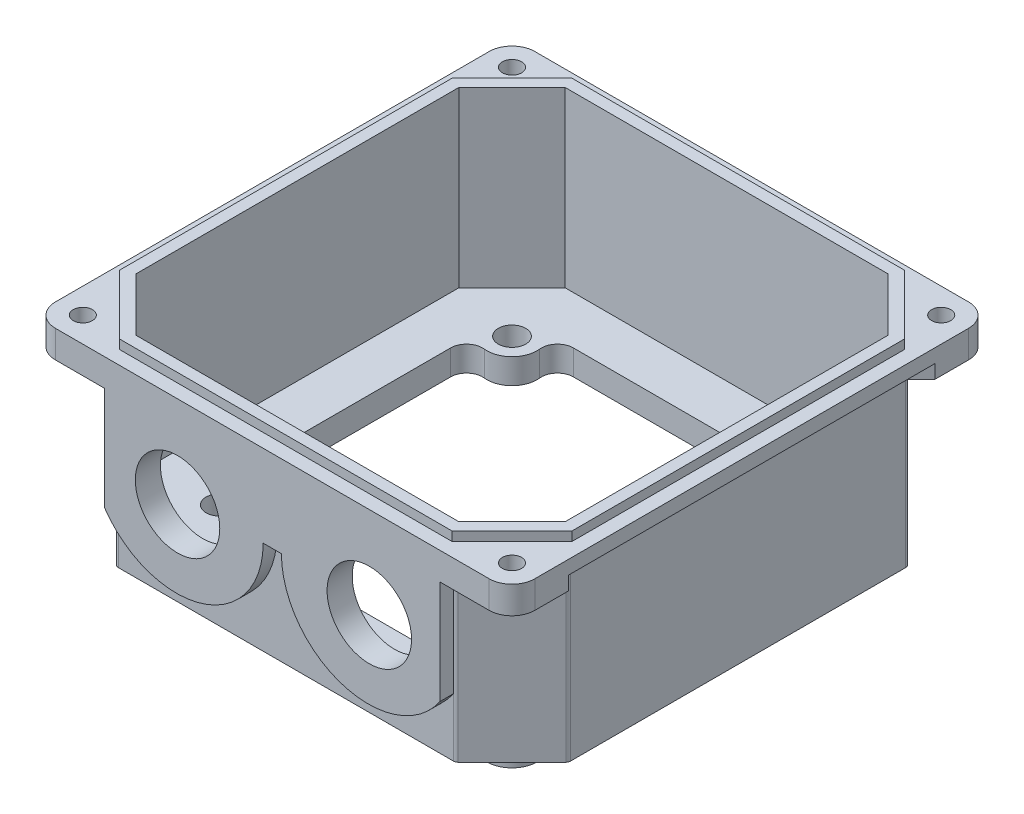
SolidWorks part; units mm, degrees
ref_plane "前视基准面" through (0, 0, 0) normal (0, 0, 1) x (1, 0, 0)
ref_plane "上视基准面" through (0, 0, 0) normal (0, 1, 0) x (1, 0, 0)
ref_plane "右视基准面" through (0, 0, 0) normal (1, 0, 0) x (0, 0, -1)
sketch "草图1" plane through (0, 0, 0) normal (0, 1, 0) x (1, 0, 0)
  line L1 (-52.5, -52.5) -> (52.5, -52.5)
  line L2 (-52.5, -52.5) -> (-52.5, 52.5)
  line L3 (-52.5, 52.5) -> (52.5, 52.5)
  line L4 (52.5, -52.5) -> (52.5, 52.5)
  line L5 (-52.5, -52.5) -> (52.5, 52.5) construction
  line L6 (-52.5, 52.5) -> (52.5, -52.5) construction
  point P0 (0, 0)
extrude "凸台-拉伸1" add sketch "草图1" along normal blind 38.5
sketch "草图2" plane through (0, 0, 0) normal (0, -1, 0) x (-1, 0, 0)
  line L1 (36, 41.5) -> (-36, 41.5)
  line L2 (41.5, 36) -> (41.5, -36)
  line L3 (36, -41.5) -> (-36, -41.5)
  line L4 (-41.5, 36) -> (-41.5, -36)
  line L5 (41.5, 41.5) -> (-41.5, -41.5) construction
  line L6 (41.5, -41.5) -> (-41.5, 41.5) construction
  line L7 (38.5, 44) -> (-38.5, 44)
  line L8 (44, 38.5) -> (44, -38.5)
  line L9 (38.5, -44) -> (-38.5, -44)
  line L10 (-44, 38.5) -> (-44, -38.5)
  line L11 (44, 44) -> (-44, -44) construction
  line L12 (44, -44) -> (-44, 44) construction
  arc A0 (38.5, 44) -> (44, 38.5) centre (38.5, 38.5) cw
  arc A1 (36, 41.5) -> (41.5, 36) centre (36, 36) cw
  arc A2 (-38.5, 44) -> (-44, 38.5) centre (-38.5, 38.5) ccw
  arc A3 (-36, 41.5) -> (-41.5, 36) centre (-36, 36) ccw
  arc A4 (-36, -41.5) -> (-41.5, -36) centre (-36, -36) cw
  arc A5 (-38.5, -44) -> (-44, -38.5) centre (-38.5, -38.5) cw
  arc A6 (41.5, -36) -> (36, -41.5) centre (36, -36) cw
  arc A7 (44, -38.5) -> (38.5, -44) centre (38.5, -38.5) cw
  point P0 (0, 0)
  point P5 (0, 0)
  dimension "D1" = 5.5
extrude "凸台-拉伸2" add sketch "草图2" along normal blind 2
sketch "草图3" plane through (0, 0, 0) normal (0, -1, 0) x (-1, 0, 0)
  line L2 (36.5, 23.0557) -> (36.5, -23.0557)
  line L5 (-36.5, 23.0557) -> (-36.5, -23.0557)
  line L6 (23.0557, 36.5) -> (-23.0557, 36.5)
  line L7 (23.0557, -36.5) -> (-23.0557, -36.5)
  line L8 (34.1213, -34.1213) -> (-34.1213, 34.1213) construction
  line L9 (34.1213, 34.1213) -> (-34.1213, -34.1213) construction
  circle A0 centre (-32, -32) radius 3
  arc A1 (-26.5341, -32.6111) -> (-32.6111, -26.5341) centre (-32, -32) ccw
  arc A2 (-32.6111, 26.5341) -> (-26.5341, 32.6111) centre (-32, 32) ccw
  circle A3 centre (-32, 32) radius 3
  arc A4 (26.5341, 32.6111) -> (32.6111, 26.5341) centre (32, 32) ccw
  circle A5 centre (32, 32) radius 3
  circle A7 centre (32, -32) radius 3
  arc A8 (32.6111, -26.5341) -> (26.5341, -32.6111) centre (32, -32) ccw
  arc A9 (35.1623, -36.5) -> (35.8891, -35.8891) centre (32, -32) ccw
  arc A10 (-23.0557, -36.5) -> (-26.5341, -32.6111) centre (-23.0557, -33) cw
  arc A11 (-32.6111, -26.5341) -> (-36.5, -23.0557) centre (-33, -23.0557) cw
  arc A12 (-32.6111, 26.5341) -> (-36.5, 23.0557) centre (-33, 23.0557) ccw
  arc A13 (-23.0557, 36.5) -> (-26.5341, 32.6111) centre (-23.0557, 33) ccw
  arc A14 (26.5341, 32.6111) -> (23.0557, 36.5) centre (23.0557, 33) ccw
  arc A15 (36.5, 23.0557) -> (32.6111, 26.5341) centre (33, 23.0557) ccw
  arc A16 (36.5, -23.0557) -> (32.6111, -26.5341) centre (33, -23.0557) cw
  arc A17 (26.5341, -32.6111) -> (23.0557, -36.5) centre (23.0557, -33) cw
  point P0 (0, 0)
  point P23 (0, 0)
  dimension "D1" = 4
  dimension "D2" = 3.5
extrude "切除-拉伸1" cut sketch "草图3" against normal through all
sketch "草图4" plane through (0, 38.5, 0) normal (0, 1, 0) x (1, 0, 0)
  line L0 (52.5, 52.5) -> (52.5, 34.1206)
  line L1 (34.1206, 52.5) -> (52.5, 34.1206)
  line L2 (52.5, -52.5) -> (52.5, 52.5) construction
  line L3 (52.5, 52.5) -> (34.1206, 52.5)
  line L4 (52.5, -52.5) -> (34.1206, -52.5)
  line L5 (52.5, -34.1206) -> (34.1206, -52.5)
  line L6 (52.5, -52.5) -> (52.5, -34.1206)
  line L7 (-52.5, -52.5) -> (-52.5, -34.1206)
  line L8 (-34.1206, -52.5) -> (-52.5, -34.1206)
  line L9 (-52.5, -52.5) -> (-34.1206, -52.5)
  line L10 (-52.5, 52.5) -> (-34.1206, 52.5)
  line L11 (-52.5, 34.1206) -> (-34.1206, 52.5)
  line L12 (-52.5, 52.5) -> (-52.5, 34.1206)
  point P18 (0, 0)
  dimension "D1" = 4
extrude "切除-拉伸2" cut sketch "草图4" against normal through all
sketch "草图5" plane through (0, 38.5, 0) normal (0, 1, 0) x (1, 0, 0)
  line L1 (52.5, -52.5) -> (-52.5, -52.5)
  line L2 (52.5, -52.5) -> (52.5, 52.5)
  line L3 (52.5, 52.5) -> (-52.5, 52.5)
  line L4 (-52.5, -52.5) -> (-52.5, 52.5)
  line L5 (52.5, -52.5) -> (-52.5, 52.5) construction
  line L6 (52.5, 52.5) -> (-52.5, -52.5) construction
  point P0 (0, 0)
extrude "凸台-拉伸3" add sketch "草图5" along normal blind 3
sketch "草图6" plane through (0, 0, 0) normal (0, -1, 0) x (1, 0, 0)
  line L1 (-49.5, -49.5) -> (49.5, -49.5)
  line L2 (-49.5, -49.5) -> (-49.5, 49.5)
  line L3 (-49.5, 49.5) -> (49.5, 49.5)
  line L4 (49.5, -49.5) -> (49.5, 49.5)
  line L5 (-49.5, -49.5) -> (49.5, 49.5) construction
  line L6 (-49.5, 49.5) -> (49.5, -49.5) construction
  point P0 (0, 0)
extrude "切除-拉伸3" cut sketch "草图6" against normal up to surface (38.5 mm away) flip side to cut
sketch "草图7" plane through (0, 38.5, 0) normal (0, -1, 0) x (1, 0, 0)
  line L0 (37.1206, 49.5) -> (40.1206, 52.5)
  line L1 (-52.5, 52.5) -> (52.5, 52.5) construction
  line L2 (49.5, 37.1206) -> (52.5, 40.1206)
  line L3 (52.5, 52.5) -> (52.5, -52.5) construction
  line L4 (52.5, 52.5) -> (52.5, 40.1206)
  line L5 (40.1206, 52.5) -> (52.5, 52.5)
  line L6 (49.5, 37.1206) -> (37.1206, 49.5)
  line L7 (37.1206, -49.5) -> (49.5, -37.1206)
  line L8 (49.5, -37.1206) -> (52.5, -40.1206)
  line L9 (52.5, -40.1206) -> (52.5, -52.5)
  line L10 (52.5, -52.5) -> (40.1206, -52.5)
  line L11 (37.1206, -49.5) -> (40.1206, -52.5)
  line L12 (-49.5, -37.1206) -> (-37.1206, -49.5)
  line L13 (-37.1206, -49.5) -> (-40.1206, -52.5)
  line L14 (-40.1206, -52.5) -> (-52.5, -52.5)
  line L15 (-52.5, -52.5) -> (-52.5, -40.1206)
  line L16 (-49.5, -37.1206) -> (-52.5, -40.1206)
  line L17 (-37.1206, 49.5) -> (-49.5, 37.1206)
  line L18 (-49.5, 37.1206) -> (-52.5, 40.1206)
  line L19 (-52.5, 40.1206) -> (-52.5, 52.5)
  line L20 (-52.5, 52.5) -> (-40.1206, 52.5)
  line L21 (-37.1206, 49.5) -> (-40.1206, 52.5)
  point P30 (0, 0)
  dimension "D1" = 4
extrude "凸台-拉伸4" add sketch "草图7" along normal blind 3
sketch "草图8" plane through (0, 41.5, 0) normal (0, 1, 0) x (1, 0, 0)
  line L0 (0, 0) -> (41.189, 41.189) construction
  line L1 (-35.3779, -47) -> (35.3779, -47)
  line L2 (-47, -35.3779) -> (-47, 35.3779)
  line L3 (-35.3779, 47) -> (35.3779, 47)
  line L4 (47, -35.3779) -> (47, 35.3779)
  line L5 (-41.189, -41.189) -> (41.189, 41.189) construction
  line L6 (-41.189, 41.189) -> (41.189, -41.189) construction
  line L7 (35.3779, 47) -> (47, 35.3779)
  line L9 (47, -35.3779) -> (35.3779, -47)
  line L10 (-35.3779, -47) -> (-47, -35.3779)
  line L11 (-47, 35.3779) -> (-35.3779, 47)
  point P0 (0, 0)
  point P12 (0, 0)
  point P15 (0, 0)
  point P18 (0, 0)
  point P21 (0, 0)
  dimension "D1" = 58.25
  dimension "D2" = 4
extrude "切除-拉伸4" cut sketch "草图8" against normal blind 36
sketch "草图9" plane through (0, 41.5, 0) normal (0, 1, 0) x (1, 0, 0)
  line L1 (35.3779, -47) -> (47, -35.3779) construction
  line L2 (-35.3779, -47) -> (35.3779, -47) construction
  line L4 (49.5, 36.4135) -> (36.4135, 49.5)
  line L5 (36.4135, -49.5) -> (-36.4135, -49.5)
  line L6 (49.5, -36.4135) -> (49.5, 36.4135)
  line L7 (36.4135, 49.5) -> (-36.4135, 49.5)
  line L14 (-47, -35.3779) -> (-35.3779, -47) construction
  line L15 (35.3779, -47) -> (47, -35.3779)
  line L16 (-35.3779, -47) -> (35.3779, -47)
  line L17 (-47, 35.3779) -> (-47, -35.3779) construction
  line L20 (-49.5, -36.4135) -> (-49.5, 36.4135)
  line L23 (36.4135, -49.5) -> (49.5, -36.4135)
  line L24 (-36.4135, 49.5) -> (-49.5, 36.4135)
  line L25 (-49.5, -36.4135) -> (-36.4135, -49.5)
  line L26 (-35.3779, -47) -> (-47, -35.3779)
  line L27 (-47, -35.3779) -> (-47, 35.3779)
  line L28 (-47, 35.3779) -> (-35.3779, 47)
  line L29 (-35.3779, 47) -> (35.3779, 47)
  line L30 (35.3779, 47) -> (47, 35.3779)
  line L31 (47, -35.3779) -> (47, 35.3779) construction
  line L32 (47, 35.3779) -> (47, -35.3779)
  point P0 (0, 0)
  point P4 (-42.9567, -42.9567)
  point P5 (0, -49.5)
  point P19 (0, 0)
  point P22 (0, 0)
  point P25 (0, 0)
  point P28 (0, 0)
  dimension "D1" = 4
  dimension "D2" = 2.5
  dimension "D3" = 2.5
  dimension "D4" = 2.5
  dimension "D5" = 2.5
extrude "凸台-拉伸5" add sketch "草图9" along normal blind 2
sketch "草图10" plane through (0, 41.5, 0) normal (0, 1, 0) x (1, 0, 0)
  line L0 (0, 0) -> (0, 47) construction
  line L1 (0, 47) -> (47, 47) construction
hole_wizard "M5 螺纹孔1" positions "草图11" profile "草图12" tap size "M5" standard "GB"
sketch "草图11" plane through (0, 41.5, 0) normal (0, 1, 0) x (1, 0, 0)
  point P0 (47, 47)
sketch "草图12" plane through (47, 41.5, -47) normal (1, 0, 0) x (0, 0, 1)
  line L0 (0, 0) -> (0, 13.6618)
  line L1 (0, 13.6618) -> (2.1, 12.4)
  line L2 (2.1, 12.4) -> (2.1, 0)
  line L5 (2.1, 0) -> (0, 0)
  line L10 (0, 13.6618) -> (-2.1, 12.4) construction
  line L11 (0, -6.35) -> (0, 107.95) construction
  dimension "螺纹孔钻头直径" = 4.2
  dimension "螺纹孔钻头深度" = 12.4
  dimension "导头角度" = 118
mirror "镜向1" about plane through (0, 0, 0) normal (0, 0, 1) of "M5 螺纹孔1"
mirror "镜向2" about plane through (0, 0, 0) normal (1, 0, 0) of "镜向1", "M5 螺纹孔1"
fillet "圆角1" radius 1 6 edges at (37.1206, 17.75, -49.5) (49.5, 17.75, -37.1206) (49.5, 17.75, 37.1206) (37.1206, 17.75, 49.5) (-37.1206, 17.75, 49.5) (-49.5, 17.75, 37.1206)
fillet "圆角2" radius 1 2 edges at (-49.5, 17.75, -37.1206) (-37.1206, 17.75, -49.5)
fillet "圆角3" radius 5 1 edges at (-52.5, 38.5, 52.5)
fillet "圆角4" radius 5 3 edges at (52.5, 38.5, 52.5) (52.5, 38.5, -52.5) (-52.5, 38.5, -52.5)
sketch "草图14" plane through (0, 0, 49.5) normal (0, 0, 1) x (1, 0, 0)
  line L0 (0, 43.5) -> (0, 41.5) construction
  line L1 (-36.4135, 43.5) -> (36.4135, 43.5) construction
  line L2 (-2, 23.5) -> (2, 23.5)
  line L3 (-36.7064, 41.5) -> (-36.7064, 12.8084)
  line L4 (-36.7064, 35.5) -> (-36.7064, 0) construction
  line L5 (36.7064, 41.5) -> (36.7064, 12.8084)
  line L6 (36.7064, 0) -> (36.7064, 35.5) construction
  line L10 (-36.7064, 41.5) -> (36.7064, 41.5)
  line L11 (0, 41.5) -> (47, 41.5) construction
  arc A2 (-2, 23.5) -> (-36.7064, 12.8084) centre (-21, 23.5) cw
  arc A3 (2, 23.5) -> (36.7064, 12.8084) centre (21, 23.5) ccw
extrude "凸台-拉伸6" add sketch "草图14" along normal up to surface (3 mm away)
sketch "草图15" plane through (0, 0, 52.5) normal (0, 0, 1) x (1, 0, 0)
  line L0 (-40.1206, 35.5) -> (-36.7064, 35.5)
  line L1 (-36.7064, 12.8084) -> (-36.7064, 38.5) construction
  line L2 (-36.7064, 35.5) -> (-36.7064, 38.5)
  line L3 (-36.7064, 38.5) -> (-40.1206, 38.5)
  line L4 (-40.1206, 38.5) -> (-40.1206, 35.5)
  line L5 (36.7064, 38.5) -> (40.1206, 38.5)
  line L6 (36.7064, 38.5) -> (40.1206, 38.5) construction
  line L7 (40.1206, 38.5) -> (40.1206, 35.5)
  line L8 (40.1206, 35.5) -> (36.7064, 35.5)
  line L9 (36.7064, 38.5) -> (36.7064, 12.8084) construction
  line L10 (36.7064, 35.5) -> (36.7064, 38.5)
extrude "凸台-拉伸7" add sketch "草图15" against normal up to surface (3 mm away)
hole_wizard "M20x1.5 螺纹孔2" positions "草图20" profile "草图21" tap size "M20x1.5" standard "GB"
sketch "草图20" plane through (0, 0, 52.5) normal (0, 0, 1) x (1, 0, 0)
  line L0 (-36.4135, 41.5) -> (36.4135, 41.5) construction
  point P0 (-20.7513, 21.5)
  point P2 (21.2487, 21.5)
  dimension "D1" = 42
  dimension "D2" = 20
sketch "草图21" plane through (-20.7513, 21.5, 52.5) normal (1, 0, 0) x (0, -1, 0)
  line L0 (0, 0) -> (0, 50.058)
  line L1 (0, 50.058) -> (9.25, 44.5)
  line L2 (9.25, 44.5) -> (9.25, 0)
  line L5 (9.25, 0) -> (0, 0)
  line L10 (0, 50.058) -> (-9.25, 44.5) construction
  line L11 (0, -6.35) -> (0, 107.95) construction
  dimension "螺纹孔钻头直径" = 18.5
  dimension "螺纹孔钻头深度" = 44.5
  dimension "导头角度" = 118
